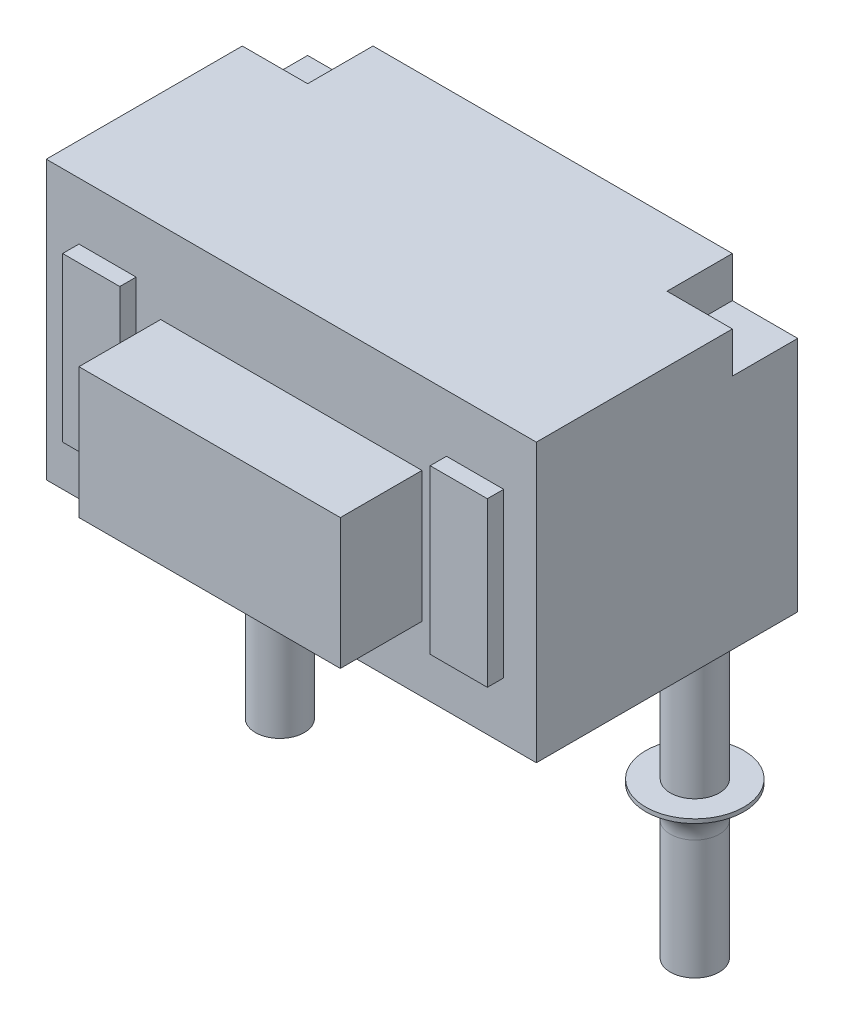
SolidWorks part; units mm, degrees
ref_plane "Plan de face" through (0, 0, 0) normal (0, 0, 1) x (1, 0, 0)
ref_plane "Plan de dessus" through (0, 0, 0) normal (0, 1, 0) x (1, 0, 0)
ref_plane "Plan de droite" through (0, 0, 0) normal (1, 0, 0) x (0, 0, -1)
sketch "Esquisse1" plane through (0, 0, 0) normal (0, 1, 0) x (1, 0, 0)
  line L1 (-3, -1.6) -> (3, -1.6)
  line L2 (-3, -1.6) -> (-3, 1.6)
  line L3 (-3, 1.6) -> (3, 1.6)
  line L4 (3, -1.6) -> (3, 1.6)
  line L5 (-3, -1.6) -> (3, 1.6) construction
  line L6 (-3, 1.6) -> (3, -1.6) construction
  point P0 (0, 0)
  dimension "D1" = 6
  dimension "D2" = 3.2
extrude "Boss.-Extru.1" add sketch "Esquisse1" along normal blind 3.4
sketch "Esquisse2" plane through (0, 3.4, 0) normal (0, 1, 0) x (1, 0, 0)
  line L1 (-3, 1.6) -> (-2.2, 1.6)
  line L2 (-3, 1.6) -> (-3, 0.8)
  line L3 (-3, 0.8) -> (-2.2, 0.8)
  line L4 (-2.2, 1.6) -> (-2.2, 0.8)
  line L5 (3, 1.6) -> (2.2, 1.6)
  line L6 (3, 1.6) -> (3, 0.8)
  line L7 (3, 0.8) -> (2.2, 0.8)
  line L8 (2.2, 1.6) -> (2.2, 0.8)
  dimension "D1" = 0.8
extrude "Enlèv. mat.-Extru.1" cut sketch "Esquisse2" against normal blind 0.5
sketch "Esquisse3" plane through (0, 0, 1.6) normal (0, 0, 1) x (1, 0, 0)
  line L0 (-3, 3.4) -> (-3, 0) construction
  line L1 (-2.6, 2.7) -> (-1.9, 2.7)
  line L2 (-2.6, 2.7) -> (-2.6, 0.7)
  line L3 (-2.6, 0.7) -> (-1.9, 0.7)
  line L4 (-1.9, 2.7) -> (-1.9, 0.7)
  line L5 (-1.6, 2.4) -> (1.6, 2.4)
  line L6 (-1.6, 2.4) -> (-1.6, 0.8)
  line L7 (-1.6, 0.8) -> (1.6, 0.8)
  line L8 (1.6, 2.4) -> (1.6, 0.8)
  line L9 (1.9, 2.7) -> (2.6, 2.7)
  line L10 (1.9, 2.7) -> (1.9, 0.7)
  line L11 (1.9, 0.7) -> (2.6, 0.7)
  line L12 (2.6, 2.7) -> (2.6, 0.7)
  line L13 (3, 3.4) -> (3, 0) construction
  line L14 (-3, 0) -> (3, 0) construction
  line L15 (-3, 3.4) -> (3, 3.4) construction
  dimension "D1" = 0.7
  dimension "D2" = 0.4
  dimension "D3" = 0.4
  dimension "D4" = 0.7
  dimension "D5" = 0.8
  dimension "D6" = 1
  dimension "D7" = 0.3
  dimension "D8" = 0.3
  dimension "D9" = 0.7
extrude "Boss.-Extru.2" add sketch "Esquisse3" along normal blind 0.2
sketch "Esquisse4" plane through (0, 0, 1.8) normal (0, 0, 1) x (1, 0, 0)
  line L4 (-1.6, 2.4) -> (-1.6, 0.8)
  line L5 (-1.6, 0.8) -> (1.6, 0.8)
  line L6 (1.6, 0.8) -> (1.6, 2.4)
  line L7 (1.6, 2.4) -> (-1.6, 2.4)
  line L8 (-1.6, 2.4) -> (-1.6, 0.8)
  line L9 (-1.6, 0.8) -> (1.6, 0.8)
  line L10 (1.6, 0.8) -> (1.6, 2.4)
  line L11 (1.6, 2.4) -> (-1.6, 2.4)
  dimension "D1" = 0
extrude "Boss.-Extru.3" add sketch "Esquisse4" along normal blind 0.8
sketch "Esquisse5" plane through (0, 0, 0) normal (0, -1, 0) x (1, 0, 0)
  line L3 (-2.54, -0.8) -> (2.54, -0.8) construction
  line L4 (0, 0) -> (0, -0.8) construction
  circle A0 centre (-2.54, -0.8) radius 0.3
  circle A1 centre (2.54, -0.8) radius 0.3
  dimension "D1" = 0.6
  dimension "D2" = 5.08
  dimension "D3" = 0.8
extrude "Boss.-Extru.4" add sketch "Esquisse5" along normal blind 3.5
ref_plane "Plan1" through (0, -1.6, 0) normal (0, -1, 0) x (-1, 0, 0)
sketch "Esquisse6" plane through (0, -1.6, 0) normal (0, -1, 0) x (-1, 0, 0)
  circle A0 centre (-2.54, 0.8) radius 0.6
  circle A1 centre (2.54, 0.8) radius 0.6
extrude "Boss.-Extru.5" add sketch "Esquisse6" along normal blind 0.05
fillet "Congé1" radius 0.4 2 edges at (2.54, -1.65, -1.1) (-2.54, -1.65, -1.1)
